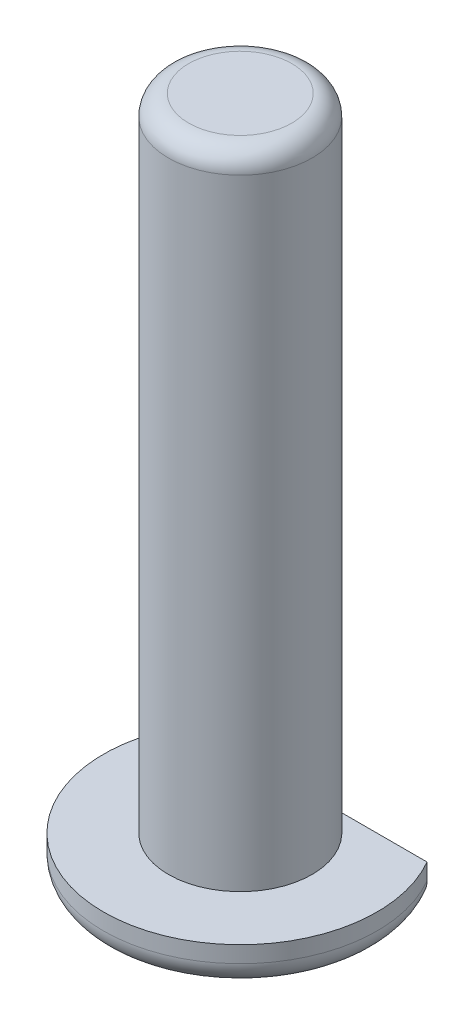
SolidWorks part; units mm, degrees
ref_plane "Front Plane" through (0, 0, 0) normal (0, 0, 1) x (1, 0, 0)
ref_plane "Top Plane" through (0, 0, 0) normal (0, 1, 0) x (1, 0, 0)
ref_plane "Right Plane" through (0, 0, 0) normal (1, 0, 0) x (0, 0, -1)
sketch "Sketch1" plane through (0, 0, 0) normal (0, 1, 0) x (1, 0, 0)
  circle A0 centre (0, 0) radius 2.667
  dimension "D1" = 5.334
extrude "Boss-Extrude1" add sketch "Sketch1" along normal blind 22.3012
sketch "Sketch2" plane through (0, 0, 0) normal (0, -1, 0) x (1, 0, 0)
  circle A0 centre (0, 0) radius 5.08
  dimension "D1" = 10.16
extrude "Boss-Extrude2" add sketch "Sketch2" along normal blind 1.5
fillet "Fillet1" radius 0.889 1 edges at (0, -1.5, -5.08)
sketch "Sketch3" plane through (0, 22.3012, 0) normal (0, 1, 0) x (1, 0, 0)
  circle A0 centre (0, 0) radius 2.667
  circle A1 centre (0, 0) radius 2.667 construction
extrude "Boss-Extrude3" add sketch "Sketch3" along normal blind 1.5
fillet "Fillet2" radius 0.75 1 edges at (0, 23.8012, 2.667)
sketch "Sketch4" plane through (0, 0, 0) normal (0, 1, 0) x (1, 0, 0)
  line L0 (4.3994, 2.54) -> (-4.3994, 2.54)
  circle A0 centre (0, 0) radius 2.54 construction
  circle A1 centre (0, 0) radius 2.667 construction
  circle A2 centre (0, 0) radius 2.667 construction
  circle A3 centre (0, 0) radius 5.08 construction
  arc A4 (4.3994, 2.54) -> (-4.3994, 2.54) centre (0, 0) ccw
  point P11 (0, 2.54)
  dimension "D1" = 5.08
extrude "Cut-Extrude3" cut sketch "Sketch4" against normal through all both and the other way through all
